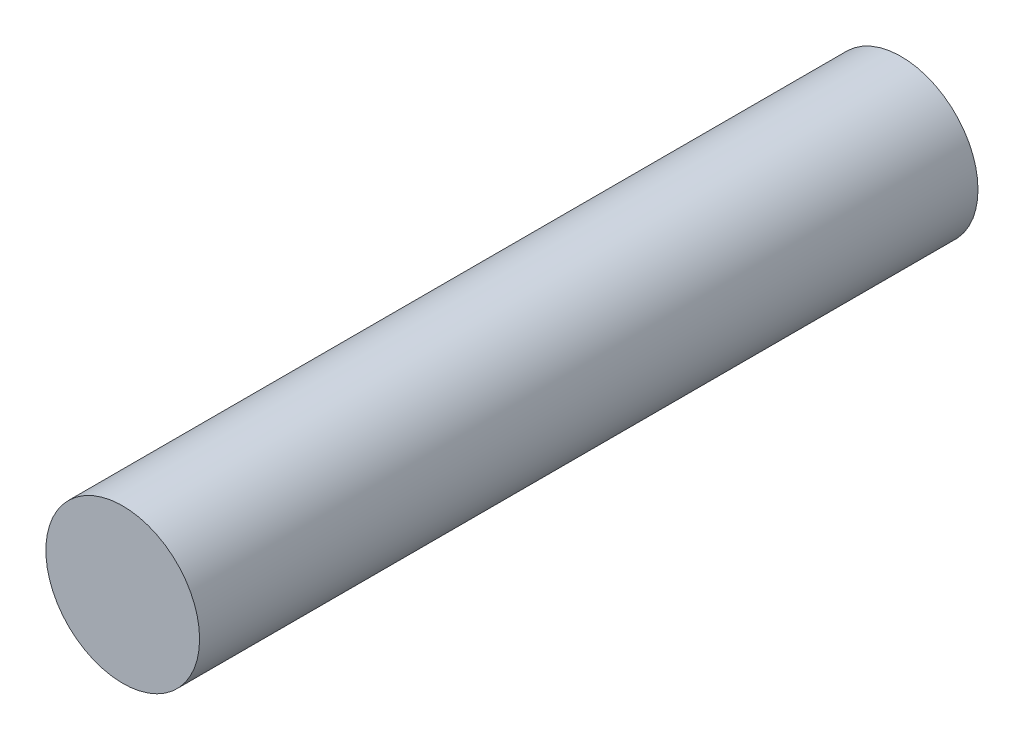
SolidWorks part; units mm, degrees
ref_plane "Ebene vorne" through (0, 0, 0) normal (0, 0, 1) x (1, 0, 0)
ref_plane "Ebene oben" through (0, 0, 0) normal (0, 1, 0) x (1, 0, 0)
ref_plane "Ebene rechts" through (0, 0, 0) normal (1, 0, 0) x (0, 0, -1)
sketch "Skizze1" plane through (0, 0, 0) normal (0, 0, 1) x (1, 0, 0)
  circle A0 centre (0, 0) radius 3.95
  dimension "D1" = 7.9
extrude "Aufsatz-Linear austragen1" add sketch "Skizze1" along normal blind 40
